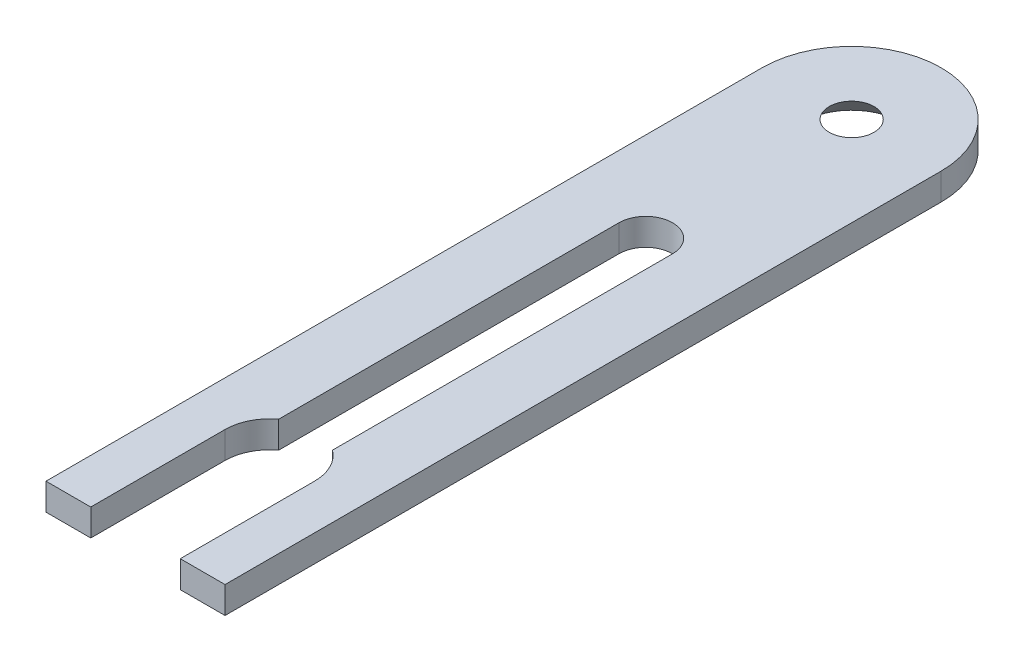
SolidWorks part; units mm, degrees
ref_plane "Front" through (0, 0, 0) normal (0, 0, 1) x (1, 0, 0)
ref_plane "Top" through (0, 0, 0) normal (0, 1, 0) x (1, 0, 0)
ref_plane "Right" through (0, 0, 0) normal (1, 0, 0) x (0, 0, -1)
sketch "Sketch1" plane through (0, 0, 0) normal (0, 1, 0) x (1, 0, 0)
  line L0 (15, 0) -> (20, 0)
  line L1 (0, 0) -> (5, 0)
  line L2 (0, 0) -> (0, 80)
  line L4 (20, 0) -> (20, 80)
  line L8 (7, 57) -> (7, 19)
  line L9 (13, 57) -> (13, 19)
  line L10 (15, 15) -> (15, 0)
  line L12 (5, 15) -> (5, 0)
  circle A0 centre (10, 80) radius 2.5
  arc A1 (20, 80) -> (0, 80) centre (10, 80) ccw
  arc A2 (13, 57) -> (7, 57) centre (10, 57) ccw
  arc A3 (15, 15) -> (13, 19) centre (10, 15) ccw
  arc A4 (7, 19) -> (5, 15) centre (10, 15) ccw
extrude "Extrude1" add sketch "Sketch1" along normal blind 3
draft "Draft1" type of draft neutral plane draft angle 45 faces to draft 1 parameters "D1"=45
